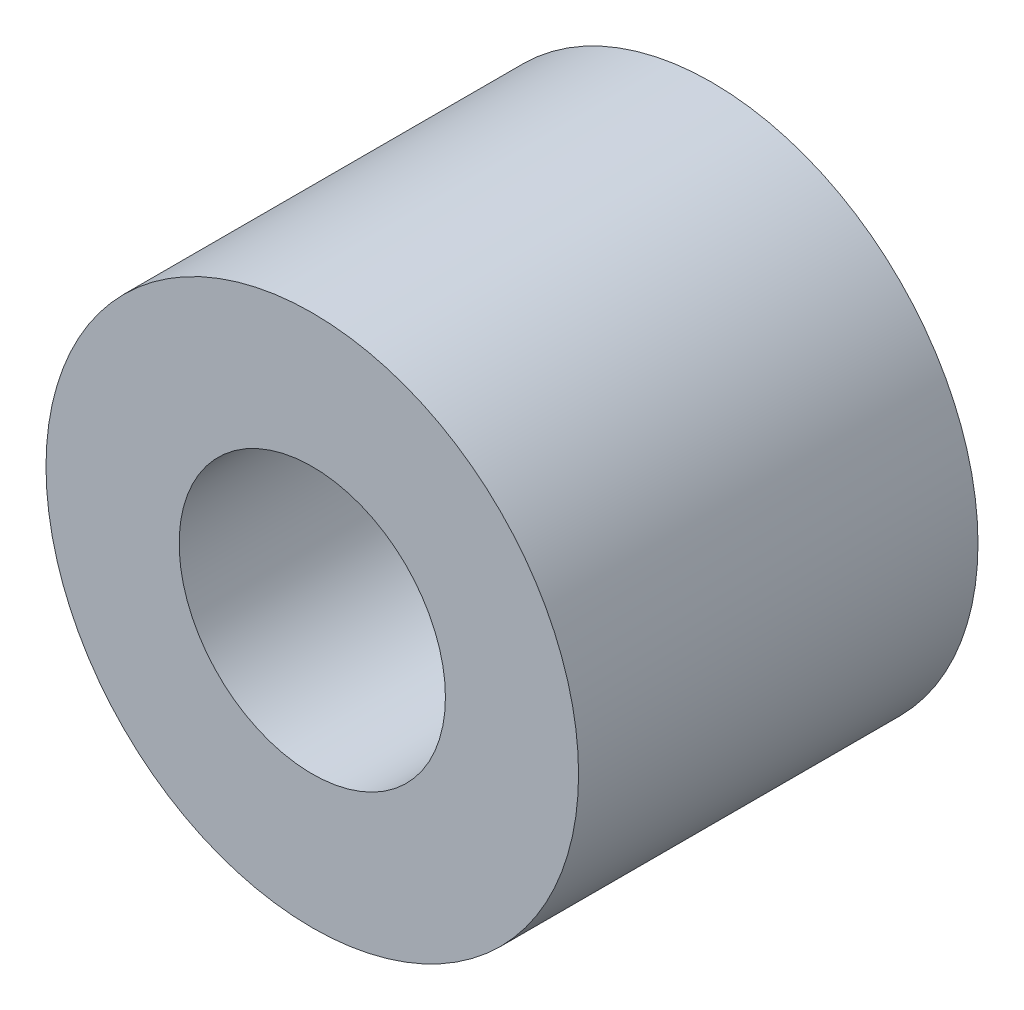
SolidWorks part; units mm, degrees
ref_plane "Plan1" through (0, 0, 0) normal (0, 0, 1) x (1, 0, 0)
ref_plane "Plan2" through (0, 0, 0) normal (0, 1, 0) x (1, 0, 0)
ref_plane "Plan3" through (0, 0, 0) normal (1, 0, 0) x (0, 0, -1)
sketch "Esquisse1" plane through (0, 0, 0) normal (0, 0, 1) x (1, 0, 0)
  circle A0 centre (0, 0) radius 10
  dimension "D1" = 20
extrude "Base-Extru.-Mince" add sketch "Esquisse1" along normal blind 15 thin
